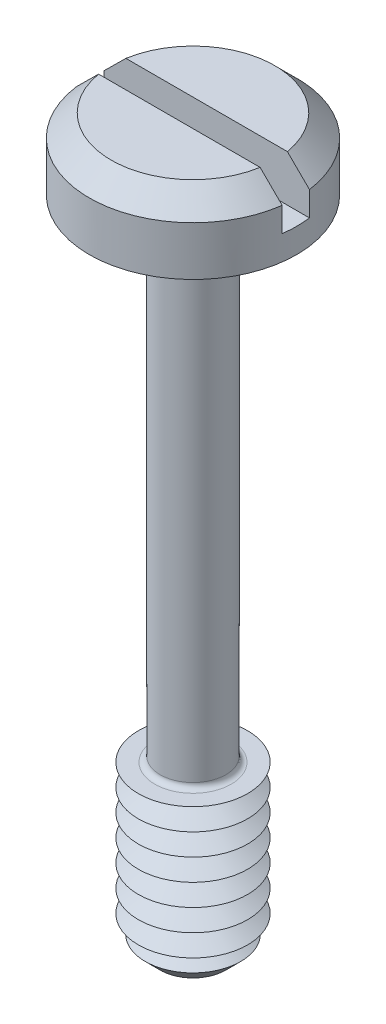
SolidWorks part; units mm, degrees
ref_plane "Front Plane" through (0, 0, 0) normal (0, 0, 1) x (1, 0, 0)
ref_plane "Top Plane" through (0, 0, 0) normal (0, 1, 0) x (1, 0, 0)
ref_plane "Right Plane" through (0, 0, 0) normal (1, 0, 0) x (0, 0, -1)
sketch "Sketch1" plane through (0, 0, 0) normal (0, 1, 0) x (1, 0, 0)
  circle A0 centre (0, 0) radius 1.9
  dimension "D1" = 3.8
extrude "Boss-Extrude1" add sketch "Sketch1" along normal blind 1.3
sketch "Sketch2" plane through (0, 0, 0) normal (0, -1, 0) x (1, 0, 0)
  circle A0 centre (0, 0) radius 0.6
  dimension "D1" = 1.2
extrude "Boss-Extrude2" add sketch "Sketch2" along normal blind 12
sketch "Sketch3" plane through (0, -12, 0) normal (0, -1, 0) x (1, 0, 0)
  circle A0 centre (0, 0) radius 1
  dimension "D1" = 2
extrude "Boss-Extrude3" add sketch "Sketch3" against normal blind 3
chamfer "Chamfer1" distance 0.4 angle 45 1 edges at (0, -12, -1)
sketch "Sketch4" plane through (0, 0, 0) normal (1, 0, 0) x (0, 0, -1)
  line L0 (0, -6.5871) -> (0, -12.0372) construction
sketch "Sketch5" plane through (0, 0, 0) normal (1, 0, 0) x (0, 0, -1)
  line L0 (-1, -9) -> (-0.6536, -9.2)
  line L1 (-0.6536, -9.2) -> (-1, -9.4)
  line L2 (-1, -9) -> (-1, -11.6) construction
  line L3 (-1, -9.4) -> (-1, -9)
  dimension "D1" = 0.4
revolve "Cut-Revolve1" cut sketch "Sketch5" angle 360 about L0
pattern_linear "LPattern1" count 7 spacing 0.4 along (0, -1, 0) of "Cut-Revolve1"
fillet "Fillet1" radius 0.1 2 edges at (0, -9, -0.6) (0, 0, -0.6)
chamfer "Chamfer2" distance 0.4 angle 45 1 edges at (0, 1.3, 1.9)
sketch "Sketch6" plane through (0, 1.3, 0) normal (0, 1, 0) x (1, 0, 0)
  line L1 (1.9, -0.25) -> (-1.9, -0.25)
  line L2 (1.9, -0.25) -> (1.9, 0.25)
  line L3 (1.9, 0.25) -> (-1.9, 0.25)
  line L4 (-1.9, -0.25) -> (-1.9, 0.25)
  line L5 (1.9, -0.25) -> (-1.9, 0.25) construction
  line L6 (1.9, 0.25) -> (-1.9, -0.25) construction
  circle A0 centre (0, 0) radius 1.9 construction
  point P0 (0, 0)
  dimension "D1" = 0.5
extrude "Cut-Extrude1" cut sketch "Sketch6" against normal blind 0.85
